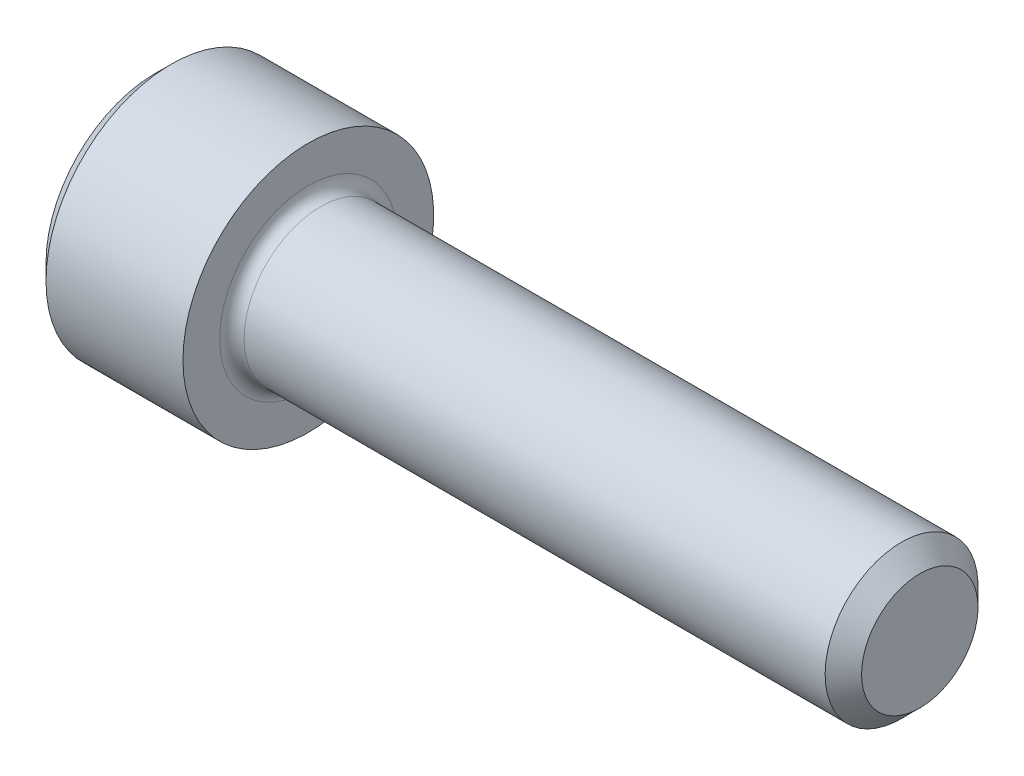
SolidWorks part; units mm, degrees
ref_plane "Plane1" through (0, 0, 0) normal (0, 0, 1) x (1, 0, 0)
ref_plane "Plane2" through (0, 0, 0) normal (0, 1, 0) x (1, 0, 0)
ref_plane "Plane3" through (0, 0, 0) normal (1, 0, 0) x (0, 0, -1)
sketch "BodySke" plane through (0, 0, 0) normal (0, 0, 1) x (1, 0, 0)
  line L0 (0, 0) -> (0, 2.2733)
  line L1 (0.3302, 2.6035) -> (3.175, 2.6035)
  line L2 (3.175, 2.6035) -> (3.175, 1.5875)
  line L3 (3.175, 1.5875) -> (15.4965, 1.5875)
  line L4 (15.875, 1.209) -> (15.875, 0)
  line L5 (15.875, 0) -> (0, 0)
  line L6 (-31.75, 0) -> (127, 0) construction
  line L7 (0, 2.2733) -> (0.3302, 2.6035)
  line L8 (15.875, 1.209) -> (15.4965, 1.5875)
  line L9 (0, -2.2733) -> (0.3302, -2.6035) construction
  line L10 (15.875, -1.209) -> (15.4965, -1.5875) construction
  line L11 (3.81, 9.525) -> (3.81, 3.175) construction
  line L12 (3.175, 9.525) -> (3.175, 3.175) construction
  line L13 (-22.225, 9.525) -> (-22.225, 3.175) construction
  dimension "Diameter" = 3.175
  dimension "Head_ht" = 3.175
  dimension "Length" = 12.7
  dimension "Body_ch_ang" = 45
  dimension "Head_dia" = 5.207
  dimension "Head_ch_ang" = 45
  dimension "Head_side_ht" = 2.8448
  dimension "Minor_dia" = 2.4181
  dimension "Advance" = 0.635
  dimension "Thread_nom" = 12.7
  dimension "Thread_length" = 38.1
revolve "Base-Revolve" add sketch "BodySke"
fillet "Fillet1" radius 0.254 1 edges at (3.175, 0, 1.5875)
sketch "Sketch2" plane through (0, 0, 0) normal (0, 0, 1) x (1, 0, 0)
  line L0 (0, 1.1938) -> (1.4478, 1.1938)
  line L1 (1.4478, 1.1938) -> (2.137, 0)
  line L2 (-31.75, 0) -> (127, 0) construction
  line L3 (2.137, 0) -> (0, 0)
  line L4 (0, 0) -> (0, 1.1938)
  line L5 (0, 2.2733) -> (0, -2.2733) construction
  line L6 (0, 0) -> (47.625, 0) construction
  line L7 (3.175, -2.6035) -> (3.175, 2.6035) construction
  dimension "D1" = 1.1938
  dimension "D2" = 60
  dimension "Wall_thickness" = 1.7272
revolve "Hex-PreBroach" cut sketch "Sketch2" angle 360 about L6
sketch "Sketch3" plane through (0, 0, 0) normal (-1, 0, 0) x (0, 0.5, 0.866)
  line L0 (0.6892, 1.1938) -> (-0.6892, 1.1938)
  line L1 (-0.6892, 1.1938) -> (-1.3785, 0)
  line L2 (0.6892, 1.1938) -> (1.3785, 0)
  line L3 (0.6892, -1.1938) -> (1.3785, 0)
  line L4 (0.6892, -1.1938) -> (-0.6892, -1.1938)
  line L5 (-0.6892, -1.1938) -> (-1.3785, 0)
  dimension "D1" = 1.1938
  dimension "D2" = 1.1938
  dimension "Hex_size" = 2.3876
extrude "Hex" cut sketch "Sketch3" against normal blind 1.4478
sketch "Sketch4" plane through (0, 0, 0) normal (-1, 0, 0) x (0, 0, 1)
  line L0 (0, 0) -> (1.4605, 0)
  line L1 (0, 0) -> (6.1484, 3.5498) construction
  line L2 (0, 0) -> (0.7302, 1.2648)
  line L3 (1.2009, 0.3267) -> (1.3933, 0.4378)
  line L4 (0.8834, 0.8767) -> (1.0758, 0.9877)
  arc A0 (1.2009, 0.3267) -> (0.8834, 0.8767) centre (0, 0) ccw
  arc A1 (1.4605, 0) -> (1.3933, 0.4378) centre (0, 0) ccw
  arc A2 (0.7302, 1.2648) -> (1.0758, 0.9877) centre (0, 0) cw
  dimension "D1" = 30
  dimension "Spline_n_dim" = 2.4892
  dimension "Spline_m_dim" = 2.921
  dimension "D2" = 60
  dimension "D3" = 0.3175
  dimension "Spline_p_dim" = 0.635
extrude "Spline" [suppressed] cut sketch "Sketch4" against normal blind 1.4478
pattern_circular "CirPattern1" [suppressed] count 6 every 60
sketch "Sketch5" plane through (0, 0, 0) normal (0, 0, 1) x (1, 0, 0)
  line L0 (-31.75, 0) -> (127, 0) construction
  line L2 (0, 2.2733) -> (0, -2.2733) construction
  circle A0 centre (1.143, 0) radius 0.4445
  dimension "Drilled_hole_dia" = 0.889
  dimension "Drilled_hole_loc" = 1.143
extrude "Hole" [suppressed] cut sketch "Sketch5" against normal through all and the other way through all
pattern_circular "Drilled-4" [suppressed] count 2 every 60
pattern_circular "Drilled-6" [suppressed] count 3 every 60
sketch "ThdSchSke" plane through (0, 0, 0) normal (0, 0, 1) x (1, 0, 0)
  line L0 (3.81, -1.209) -> (3.545, -1.5875)
  line L1 (3.81, -1.209) -> (4.075, -1.5875)
  line L2 (4.075, -1.5875) -> (4.075, -1.9844)
  line L3 (-3.175, 0) -> (5.1513, 0) construction
  line L5 (4.075, -1.9844) -> (3.545, -1.9844)
  line L6 (3.545, -1.9844) -> (3.545, -1.5875)
  line L7 (0, 2.2733) -> (0, -2.2733) construction
  dimension "Thread_minor" = 2.4181
  dimension "Diameter" = 3.175
  dimension "Start" = 3.81
  dimension "SideAngle" = 55
  dimension "VeeAngle" = 70
  dimension "Overcut" = 3.9688
revolve "ThreadSchematic" [suppressed] cut sketch "ThdSchSke" angle 360 about L3
pattern_linear "ThdSchPat" [suppressed]
equation "\"D2@Sketch3\" = \"Hex_size@Sketch3\" / 2"
equation "\"D1@Sketch3\" = \"Hex_size@Sketch3\" / 2"
equation "\"D1@Sketch2\" = \"Hex_size@Sketch3\" / 2"
equation "\"D3@Sketch4\" = \"Spline_p_dim@Sketch4\" / 2"
equation "\"Thread_minor@ThreadCosmetic\"  =  \"Minor_dia@BodySke\""
equation "\"D2@CirPattern1\" = 360 / \"Num_teeth@CirPattern1\""
equation "\"Wall_thickness@Sketch2\" = \"Head_ht@BodySke\" - \"Key_eng@Hex\""
equation "\"Thread_length@ThreadCosmetic\" = ((sgn( (\"Length@BodySke\" - \"Advance@BodySke\" ) - \"Thread_nom@BodySke\" )-1)*( (\"Length@BodySke\" - \"Advance@BodySke\" ) - \"Thread_nom@BodySke\" ))/-2+ \"Thread_nom@BodySke\""
equation "\"Thread_minor@ThdSchSke\" = \"Minor_dia@BodySke\""
equation "\"Diameter@ThdSchSke\" = \"Diameter@BodySke\""
equation "\"Overcut@ThdSchSke\" = \"Diameter@BodySke\" * 1.25"
equation "\"Start@ThdSchSke\" = \"Head_ht@BodySke\" + \"Length@BodySke\" - \"Thread_length@ThreadCosmetic\"  '---Non-countersunk---"
equation "\"Num_threads@ThdSchPat\" = int( \"Thread_length@ThreadCosmetic\" / \"Advance@BodySke\" + 0.999 )  + 1"
equation "\"Advance@ThdSchPat\" = \"Thread_length@ThreadCosmetic\" /  (\"Num_threads@ThdSchPat\" - 1) 'relax it"
equation "\"Num_threads@ThdSchPat\" = \"Num_threads@ThdSchPat\" - sgn( \"Num_threads@ThdSchPat\" - 1) '---chamfered tips only---"
